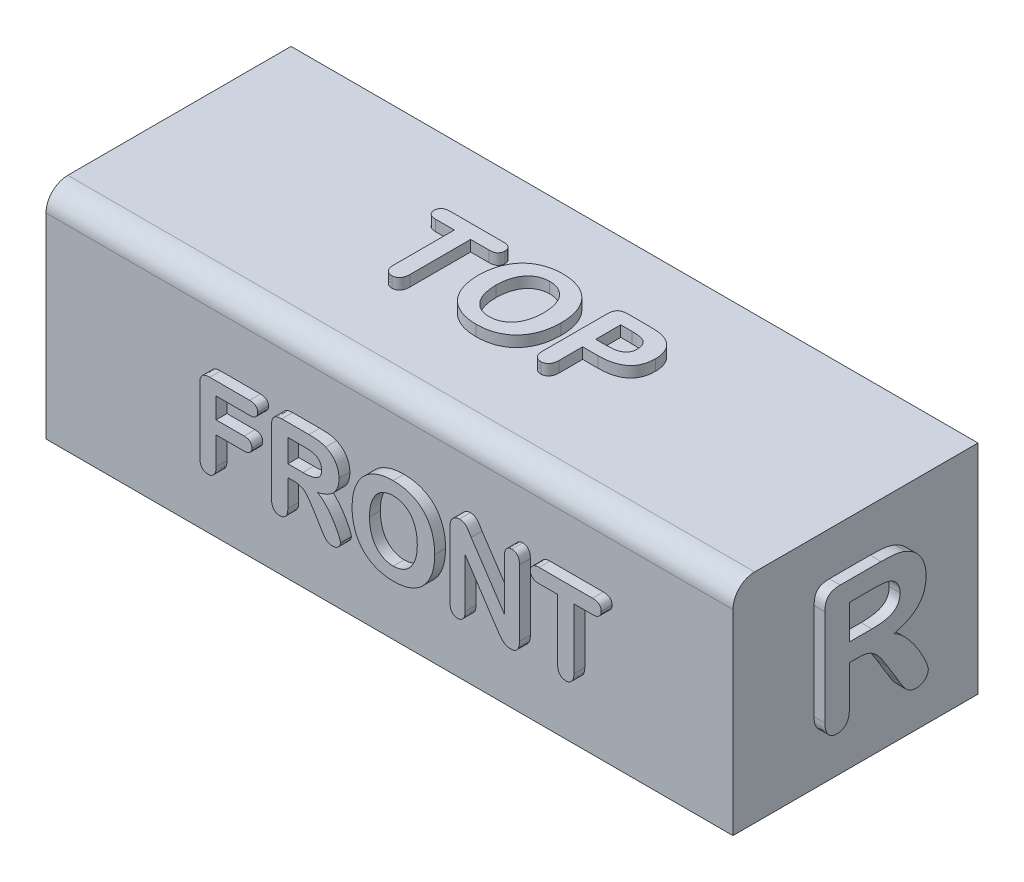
SolidWorks part; units mm, degrees
ref_plane "Front" through (0, 0, 0) normal (0, 0, 1) x (1, 0, 0)
ref_plane "Top" through (0, 0, 0) normal (0, 1, 0) x (1, 0, 0)
ref_plane "Right" through (0, 0, 0) normal (1, 0, 0) x (0, 0, -1)
sketch "Sketch2" plane through (0, 0, 0) normal (0, 1, 0) x (1, 0, 0)
  line L1 (-157.8945, -56.324) -> (157.8945, -56.324)
  line L2 (-157.8945, -56.324) -> (-157.8945, 56.324)
  line L3 (-157.8945, 56.324) -> (157.8945, 56.324)
  line L4 (157.8945, -56.324) -> (157.8945, 56.324)
  line L5 (-157.8945, -56.324) -> (157.8945, 56.324) construction
  line L6 (-157.8945, 56.324) -> (157.8945, -56.324) construction
  point P0 (0, 0)
extrude "Boss-Extrude1" add sketch "Sketch2" along normal blind 100
sketch "Sketch3" plane through (0, 100, 0) normal (0, 1, 0) x (1, 0, 0)
  text T0 "TOP" font "Arial Rounded MT Bold" height 40
extrude "Boss-Extrude2" add sketch "Sketch3" along normal blind 5
sketch "Sketch4" plane through (0, 0, 0) normal (0, -1, 0) x (1, 0, 0)
  text T0 "BOTTOM" font "Arial Rounded MT Bold" height 40
extrude "Boss-Extrude3" add sketch "Sketch4" along normal blind 5
sketch "Sketch5" plane through (0, 0, 56.324) normal (0, 0, 1) x (1, 0, 0)
  text T0 "FRONT" font "Arial Rounded MT Bold" height 40
extrude "Boss-Extrude4" add sketch "Sketch5" along normal blind 5
sketch "Sketch6" plane through (-22.841, 100.386, -56.324) normal (0, 0, -1) x (1, 0, 0)
  text T0 "BACK" font "Arial Rounded MT Bold" height 40
extrude "Boss-Extrude5" add sketch "Sketch6" along normal blind 5
sketch "Sketch7" plane through (-157.8945, 0, 0) normal (-1, 0, 0) x (0, 0, 1)
  text T0 "L" font "Arial Rounded MT Bold" height 60
extrude "Boss-Extrude6" add sketch "Sketch7" along normal blind 5
sketch "Sketch8" plane through (157.8945, 0, 0) normal (1, 0, 0) x (0, 0, -1)
  text T0 "R" font "Arial Rounded MT Bold" height 60
extrude "Boss-Extrude7" add sketch "Sketch8" along normal blind 5
fillet "Fillet1" radius 10 1 edges at (0, 100, 56.324)
